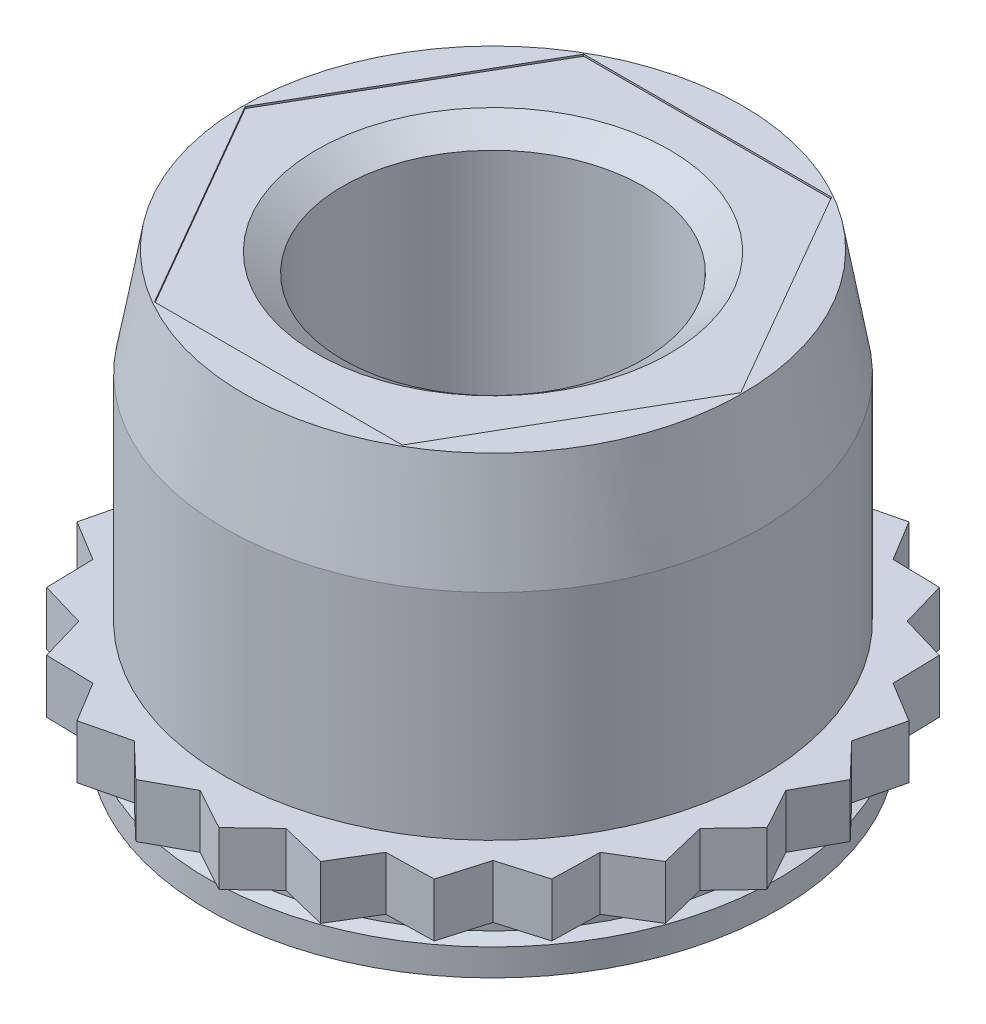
SolidWorks part; units mm, degrees
ref_plane "Plane1" through (0, 0, 0) normal (0, 0, 1) x (1, 0, 0)
ref_plane "Plane2" through (0, 0, 0) normal (0, 1, 0) x (1, 0, 0)
ref_plane "Plane3" through (0, 0, 0) normal (1, 0, 0) x (0, 0, -1)
sketch "BodySke" plane through (0, 0, 0) normal (0, 0, 1) x (1, 0, 0)
  line L0 (3.7857, -1.0716) -> (3.7858, -0.75)
  line L1 (3.75, 3) -> (3.4855, 4.5)
  line L2 (4.45, 0) -> (3.75, 0)
  line L3 (2.1, 4.5) -> (2.1, -1.5)
  line L4 (2.1, -1.5) -> (3.985, -1.5)
  line L5 (3.985, -1.5) -> (3.985, -1.125)
  line L6 (3.985, -1.125) -> (3.7857, -1.0716)
  line L7 (1.016, 0.8) -> (3.75, 0.8) construction
  line L8 (3.75, 0) -> (3.75, 3)
  line L9 (0, 0) -> (0, 15.24) construction
  line L11 (3.4855, 4.5) -> (2.1, 4.5)
  line L15 (3.7858, -0.75) -> (4.45, -0.75)
  line L16 (4.45, -0.75) -> (4.45, 0)
  dimension "D1" = 10
  dimension "D2" = 75
  dimension "C_dia" = 7.97
  dimension "A_ht" = 1.5
  dimension "Thread_min" = 4.2
  dimension "Clinch_dia" = 8.9
  dimension "C_len" = 0.375
  dimension "Clinching_ht" = 0.75
  dimension "Advance" = 0.8
  dimension "D_dia" = 7.5
  dimension "Height" = 4.5
  dimension "Groove_dia" = 7.5715
  dimension "Chamfer_ht" = 1.5
revolve "Body" add sketch "BodySke"
revolve "EndChamfer" cut sketch "EndChamferSke" angle 360 about L0
sketch "EndChamferSke" plane through (0, 0, 0) normal (0, 0, 1) x (1, 0, 0)
  line L0 (0, -2.54) -> (0, 7.62) construction
  line L1 (0, 0) -> (0, 15.24) construction
  line L2 (2.5, -1.754) -> (2.5, -1.4975)
  line L3 (2.5, -1.4975) -> (2.1, -1.2175)
  line L4 (2.1, -1.2175) -> (2.1, -1.754)
  line L5 (2.1, -1.754) -> (2.5, -1.754)
  line L6 (2.5, 4.4975) -> (2.5, 4.754)
  line L7 (2.5, 4.754) -> (2.1, 4.754)
  line L8 (2.1, 4.754) -> (2.1, 4.2175)
  line L9 (2.1, 4.2175) -> (2.5, 4.4975)
  line L10 (3.4855, 4.5) -> (-3.4855, 4.5) construction
  line L11 (-3.985, -1.5) -> (3.985, -1.5) construction
  line L12 (2.1, 4.5) -> (-2.1, 4.5) construction
  dimension "D1" = 0.254
  dimension "Thread_nominal" = 5
  dimension "D2" = 34.99
  dimension "D3" = 0.254
  dimension "Thread_min" = 4.2
  dimension "Inset" = 0.0025
  dimension "Inset_far" = 0.0025
ref_plane "Plane4" through (0, -0.5486, 0) normal (0, 1, 0) x (-1, 0, 0)
sketch "ThdSchSke" plane through (0, 0, 0) normal (0, 0, 1) x (1, 0, 0)
  line L0 (0, -5.08) -> (0, 7.62) construction
  line L1 (0, 0) -> (0, 15.24) construction
  line L2 (0, -1.4975) -> (2.5, -1.4975) construction
  line L4 (2.5, -1.4975) -> (2.1, -1.2174)
  line L6 (2.5, -1.4975) -> (2.1, -1.7775)
  line L7 (2.1, -1.2174) -> (2.1, -1.7775)
  line L8 (2.5, -1.4975) -> (-2.5, -1.4975) construction
  dimension "Vee_angle" = 70
  dimension "Thread_nominal" = 5
  dimension "Thread_min" = 4.2
revolve "ThreadSchematic" [suppressed] cut sketch "ThdSchSke" angle 360 about L0
pattern_linear "ThdSchPat" [suppressed]
sketch "CliRinCutSke" plane through (0, -0.75, 0) normal (0, -1, 0) x (1, 0, 0)
  line L0 (0.5808, 4.4119) -> (0, 4.094)
  line L1 (0, 4.094) -> (-0.5808, 4.4119)
  line L2 (0, 0) -> (0, 5.842) construction
  arc A1 (0.5808, 4.4119) -> (-0.5808, 4.4119) centre (0, 0) ccw
  circle A2 centre (0, 0) radius 4.094 construction
  dimension "Clinch_dia" = 8.9
  dimension "Clinch_minor" = 8.188
  dimension "Angle" = 15
extrude "ClinchCut" cut sketch "CliRinCutSke" against normal blind 0.75
pattern_circular "ClinchCutPat" count 24 every 15 about axis through (0, 0, 0) along (0, 1, 0) of "ClinchCut"
sketch "HexCutSke" plane through (0, 4.5, 0) normal (0, 1, 0) x (-1, 0, 0)
  line L0 (-1.7321, 3) -> (1.7321, 3)
  line L1 (1.7321, 3) -> (3.4641, 0)
  line L2 (3.4641, 0) -> (1.7321, -3)
  line L3 (1.7321, -3) -> (-1.7321, -3)
  line L4 (-1.7321, -3) -> (-3.4641, 0)
  line L5 (-3.4641, 0) -> (-1.7321, 3)
  circle A0 centre (0, 0) radius 3.4641 construction
  circle A1 centre (0, 0) radius 3 construction
  dimension "Width_across_flats" = 6
extrude "HexCut" cut sketch "HexCutSke" against normal blind 0.0254
equation "' \"A_ht@BodySke\" = 1.5"
equation "' \"C_dia@BodySke\" = 7.97"
equation "' \"D_dia@BodySke\" = 7.5"
equation "' \"Clinch_dia@BodySke\" = 8.9"
equation "' \"Height@BodySke\" = 4.5"
equation "' \"Advance@BodySke\" = 0.8"
equation "' \"Thread_min@BodySke\" = 4.2"
equation "' \"Thread_nominal@ThreadCosmetic\" = 5"
equation "\"Width_across_flats@HexCutSke\" = \"Thread_nominal@ThreadCosmetic\" * 1.2"
equation "\"Count@ClinchCutPat\" = 24"
equation "\"Angle@ClinchCutPat\" = 360 / \"Count@ClinchCutPat\""
equation "\"Angle@CliRinCutSke\" = 360 / \"Count@ClinchCutPat\""
equation "\"Clinch_dia@CliRinCutSke\" = \"Clinch_dia@BodySke\""
equation "\"Clinch_minor@CliRinCutSke\" = \"Clinch_dia@BodySke\" * 0.92"
equation "\"C_len@BodySke\" = \"A_ht@BodySke\" * 0.25"
equation "\"Groove_dia@BodySke\" = \"C_dia@BodySke\" * 0.95"
equation "\"Clinching_ht@BodySke\" = \"A_ht@BodySke\" * 0.5"
equation "\"Depth@ClinchCut\" =  \"A_ht@BodySke\" * 0.5"
equation "\"Chamfer_ht@BodySke\" = \"Height@BodySke\" / 3"
equation "\"Thread_nominal@EndChamferSke\" = \"Thread_nominal@ThreadCosmetic\""
equation "\"Thread_min@EndChamferSke\" = \"Thread_min@BodySke\""
equation "\"D2@EndChamferSke\" = \"Vee_angle@ThdSchSke\" / 2 - 0.01"
equation "\"Thread_nominal@ThdSchSke\" = \"Thread_nominal@ThreadCosmetic\""
equation "\"Thread_min@ThdSchSke\" = \"Thread_min@BodySke\""
equation "\"Num_threads@ThdSchPat\" = int(  ( \"Height@BodySke\" + \"A_ht@BodySke\" - \"Inset@EndChamferSke\" - \"Inset_far@EndChamferSke\" ) / \"Advance@BodySke\" + 0.999 )  + 1"
equation "\"Advance@ThdSchPat\" = ( \"Height@BodySke\" + \"A_ht@BodySke\" - \"Inset@EndChamferSke\" - \"Inset_far@EndChamferSke\" ) /  (\"Num_threads@ThdSchPat\" - 1) 'relax it"
